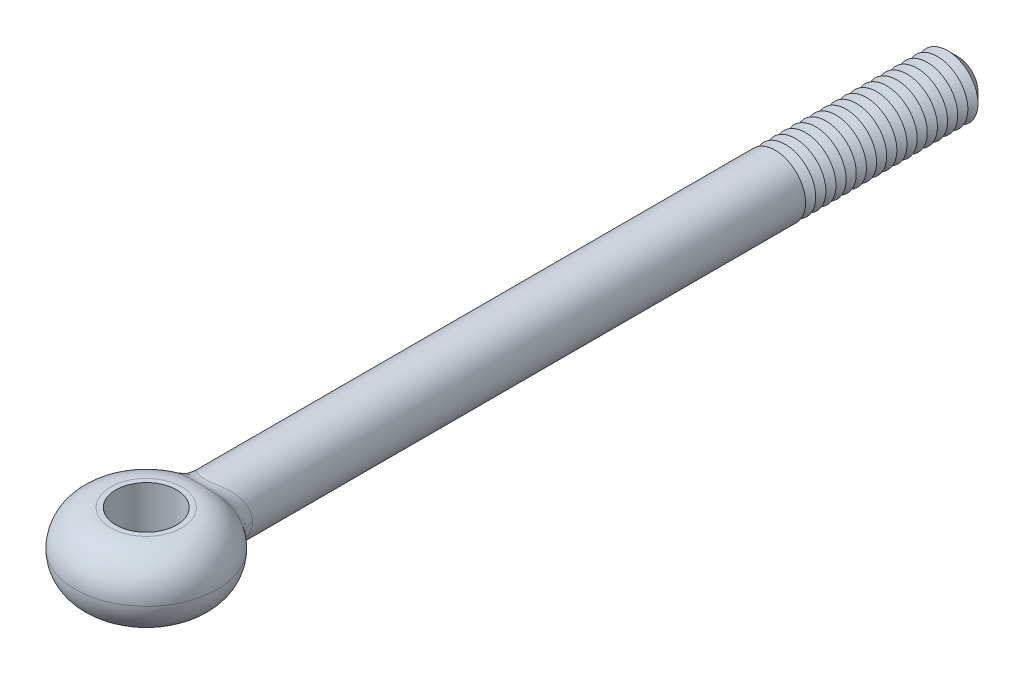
SolidWorks part; units mm, degrees
ref_plane "Front Plane" through (0, 0, 0) normal (0, 0, 1) x (1, 0, 0)
ref_plane "Top Plane" through (0, 0, 0) normal (0, 1, 0) x (1, 0, 0)
ref_plane "Right Plane" through (0, 0, 0) normal (1, 0, 0) x (0, 0, -1)
sketch "Sketch7" plane through (0, 0, 0) normal (0, 1, 0) x (1, 0, 0)
  circle A0 centre (0, 0) radius 7
  dimension "D1" = 14
extrude "Boss-Extrude3" add sketch "Sketch7" along normal mid plane 7
sketch "Sketch8" plane through (0, 0, 0) normal (0, 0, 1) x (1, 0, 0)
  circle A0 centre (0, 0) radius 3
  dimension "D1" = 6
extrude "Boss-Extrude4" add sketch "Sketch8" against normal blind 80
fillet "Fillet5" radius 3.5 2 edges at (0, -3.5, 7) (0, 3.5, 7)
fillet "Fillet6" radius 2 2 edges at (0.1487, -2.9963, -5.3068) (-0.1487, 2.9963, -5.3068)
chamfer "Chamfer1" distance 1 angle 45 1 edges at (3, 0, -80)
sketch "Sketch10" plane through (0, 0, 0) normal (0, 1, 0) x (1, 0, 0)
  line L0 (0, 28.1405) -> (0, -7.9233) construction
sketch "Sketch11" plane through (0, 0, 0) normal (0, 1, 0) x (1, 0, 0)
  line L0 (-3, 62) -> (-2.134, 62.5)
  line L1 (-3, 79) -> (-3, 7.4833) construction
  line L2 (-2.134, 62.5) -> (-3, 63)
  line L3 (-3, 63) -> (-3, 62)
  line L4 (2, 80) -> (-2, 80) construction
  dimension "D1" = 1
  dimension "D2" = 18
revolve "Cut-Revolve1" cut sketch "Sketch11" angle 360 about L0
pattern_linear "LPattern1" count 17 spacing 1 along (0, 0, -1) of "Cut-Revolve1"
sketch "Sketch12" plane through (0, 0, 0) normal (0, 1, 0) x (1, 0, 0)
  circle A0 centre (0, 0) radius 3
  dimension "D1" = 6
extrude "Cut-Extrude1" cut sketch "Sketch12" against normal mid plane 7
